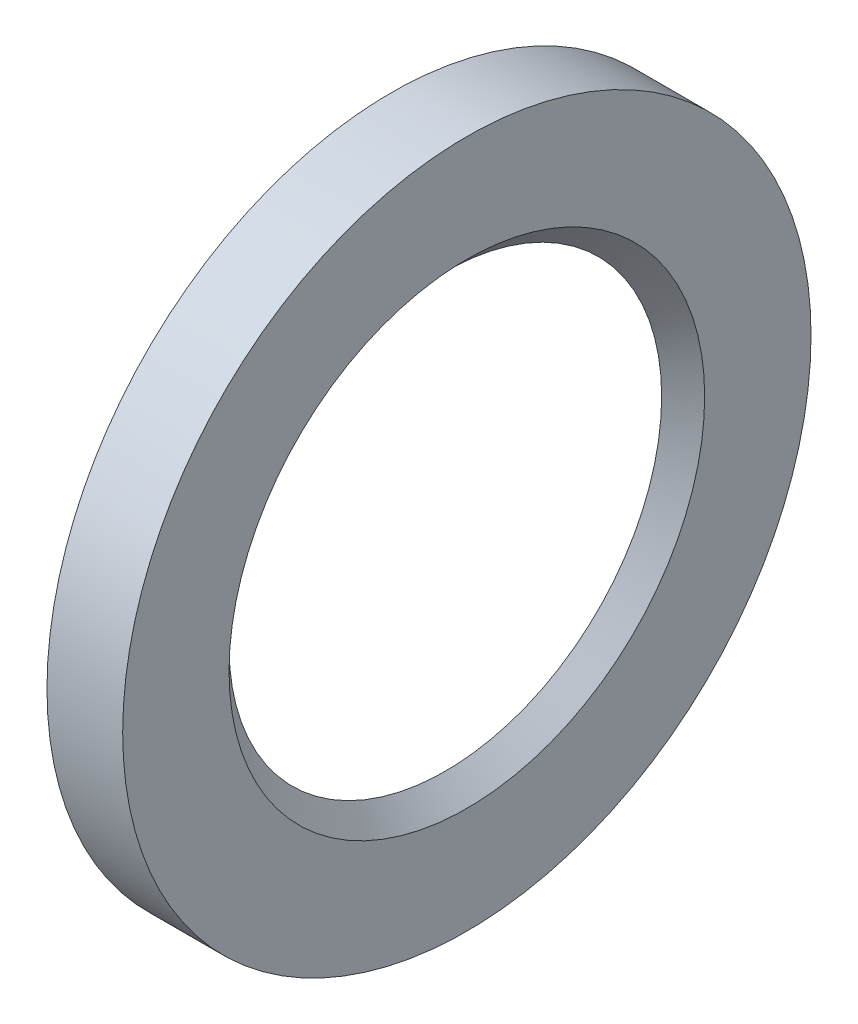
SolidWorks part; units mm, degrees
ref_plane "Front Plane" through (0, 0, 0) normal (0, 0, 1) x (1, 0, 0)
ref_plane "Top Plane" through (0, 0, 0) normal (0, 1, 0) x (1, 0, 0)
ref_plane "Right Plane" through (0, 0, 0) normal (1, 0, 0) x (0, 0, -1)
sketch "Sketch1" plane through (0, 0, 0) normal (0, 0, 1) x (1, 0, 0)
  line L0 (0, 0) -> (40.7874, 0) construction
  line L1 (0, 7.9819) -> (0, 11.2)
  line L2 (-2, 12.7) -> (0.7938, 12.7)
  line L4 (-2, 12.7) -> (-2, 11.2)
  line L5 (0.7938, 12.7) -> (0.7938, 8.7757)
  line L6 (0.7938, 8.7757) -> (0, 7.9819)
  line L7 (-2, 11.2) -> (0, 11.2)
  dimension "D1" = 7.9819
  dimension "D2" = 0.7937
  dimension "D3" = 2
  dimension "D4" = 1.5
  dimension "D5" = 45
  dimension "D6" = 12.7
revolve "Revolve1" add sketch "Sketch1" angle 360 about L0
